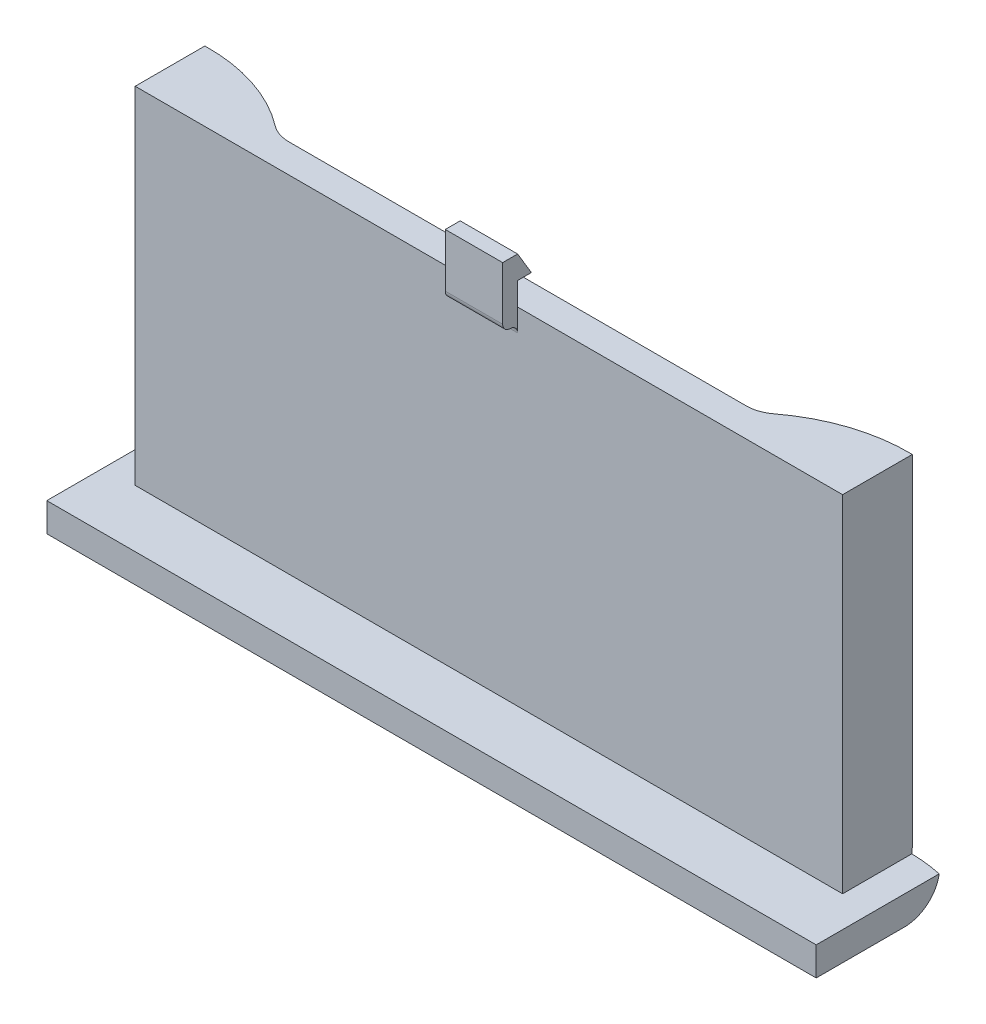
SolidWorks part; units mm, degrees
ref_plane "Plan de face" through (0, 0, 0) normal (0, 0, 1) x (1, 0, 0)
ref_plane "Plan de dessus" through (0, 0, 0) normal (0, 1, 0) x (1, 0, 0)
ref_plane "Plan de droite" through (0, 0, 0) normal (1, 0, 0) x (0, 0, -1)
sketch "Esquisse1" plane through (0, 0, 0) normal (0, 1, 0) x (1, 0, 0)
  line L0 (-45, 10.9288) -> (45, 10.9288) construction
  line L1 (45, -14.0712) -> (-45, -14.0712) construction
  line L2 (-45, 10.9288) -> (-45, -14.0712) construction
  line L3 (45, 10.9288) -> (45, -14.0712) construction
  line L4 (-30.5, 0) -> (30.5, 0) construction
  line L5 (-20.9704, 10.9288) -> (20.9704, 10.9288)
  line L6 (-27, -14.0712) -> (27, -14.0712)
  arc A0 (-20.9704, 10.9288) -> (-27, -14.0712) centre (-30.5, 0) ccw
  arc A1 (27, -14.0712) -> (20.9704, 10.9288) centre (30.5, 0) ccw
  point P8 (-27, -14.0712)
  dimension "D1" = 29
  dimension "D2" = 25
  dimension "D3" = 90
  dimension "D4" = 27
extrude "Extrusion1" add sketch "Esquisse1" along normal blind 79
fillet "Congé1" radius 3 6 edges at (0, 0, -10.9288) (44.5958, 0, -3.3997) (0, 0, 14.0712) (-44.5958, 0, -3.3997) (-20.9704, 39.5, -10.9288) (20.9704, 39.5, -10.9288)
sketch "Esquisse2" plane through (0, 0, 0) normal (0, 0, 1) x (1, 0, 0)
  line L0 (23.538, 0) -> (42, 0) construction
  line L1 (-30.8, 2.5) -> (-33.5, 2.5)
  line L2 (30.8, 2.5) -> (30.8, 32.6)
  line L3 (30.8, 32.6) -> (-30.8, 32.6)
  line L4 (-30.8, 2.5) -> (-30.8, 32.6)
  line L5 (33.5, 0) -> (-33.5, 0)
  line L6 (33.5, 0) -> (33.5, 2.5)
  line L7 (33.5, 2.5) -> (30.8, 2.5)
  line L8 (-33.5, 0) -> (-33.5, 2.5)
  dimension "D1" = 61.6
  dimension "D2" = 30.8
  dimension "D3" = 32.6
  dimension "D4" = 67
  dimension "D5" = 2.5
  dimension "D6" = 33.5
extrude "Enlèv. mat.-Extru.2" cut sketch "Esquisse2" against normal mid plane 30 flip side to cut
sketch "Esquisse3" plane through (0, 0, 0) normal (0, -1, 0) x (1, 0, 0)
  line L1 (35.6643, -3.43) -> (-35.6643, -3.43)
  line L2 (35.6643, -3.43) -> (35.6643, 21.6585)
  line L3 (35.6643, 21.6585) -> (-35.6643, 21.6585)
  line L4 (-35.6643, -3.43) -> (-35.6643, 21.6585)
  dimension "D1" = 3.43
extrude "Enlèv. mat.-Extru.3" cut sketch "Esquisse3" against normal blind 2.5
sketch "Esquisse4" plane through (0, 32.6, 0) normal (0, 1, 0) x (-1, 0, 0)
  line L0 (-19.9057, -10.9288) -> (19.9057, -10.9288) construction
  line L1 (-31.7722, -8.4288) -> (35.4696, -8.4288)
  line L2 (-31.7722, -8.4288) -> (-31.7722, 16.6794)
  line L3 (-31.7722, 16.6794) -> (35.4696, 16.6794)
  line L4 (35.4696, -8.4288) -> (35.4696, 16.6794)
  dimension "D1" = 2.5
extrude "Enlèv. mat.-Extru.4" cut sketch "Esquisse4" against normal up to surface (30.1 mm away)
sketch "Esquisse5" plane through (0, 0, 0) normal (1, 0, 0) x (0, 0, -1)
  line L0 (8.4288, 2.5) -> (8.4288, 32.6) construction
  line L1 (8.4288, 31.3) -> (7.1288, 31.3)
  line L2 (8.4288, 34.6) -> (8.4288, 31.3)
  line L3 (8.4288, 36.6) -> (7.1288, 36.6)
  line L4 (7.1288, 31.3) -> (7.1288, 36.6)
  line L5 (8.4288, 36.6) -> (9.6288, 34.6)
  line L6 (9.6288, 34.6) -> (8.4288, 34.6)
  line L7 (14.4969, 32.6) -> (8.4288, 32.6) construction
  dimension "D2" = 4
  dimension "D3" = 1.3
  dimension "D4" = 1.3
  dimension "D5" = 2.5
  dimension "D6" = 2
extrude "Extrusion2" add sketch "Esquisse5" along normal mid plane 5
fillet "Congé2" radius 0.65 4 edges at (0, 31.3, -8.4288) (-2.5, 31.3, -7.7788) (0, 31.3, -7.1288) (2.5, 31.3, -7.7788)
